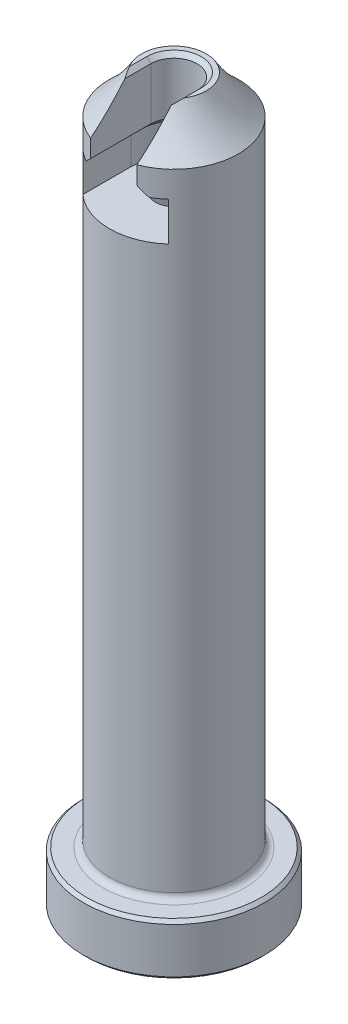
SolidWorks part; units mm, degrees
ref_plane "Front Plane" through (0, 0, 0) normal (0, 0, 1) x (1, 0, 0)
ref_plane "Top Plane" through (0, 0, 0) normal (0, 1, 0) x (1, 0, 0)
ref_plane "Right Plane" through (0, 0, 0) normal (1, 0, 0) x (0, 0, -1)
sketch "Sketch1" plane through (0, 0, 0) normal (0, 0, 1) x (1, 0, 0)
  line L0 (0, 0) -> (-11.1125, 0)
  line L1 (-11.1125, 0) -> (-11.1125, 6.35)
  line L2 (-11.1125, 6.35) -> (-7.9375, 6.35)
  line L3 (-7.9375, 6.35) -> (-7.9375, 84.1756)
  line L4 (-3.9624, 88.9) -> (0, 88.9)
  line L5 (0, 88.9) -> (0, 0)
  line L6 (0, 260.1044) -> (0, -42.4425) construction
  arc A0 (-3.9624, 88.9) -> (-7.9375, 84.1756) centre (-20.3339, 98.6404) cw
  dimension "D3" = 19.05
  dimension "D1" = 88.9
  dimension "D2" = 7.9248
  dimension "D" = 15.875
  dimension "H" = 22.225
  dimension "D4" = 6.35
  dimension "D5" = 4.7244
revolve "Revolve1" add sketch "Sketch1" angle 360 about L6
sketch "Sketch2" plane through (0, 0, 0) normal (0, -1, 0) x (1, 0, 0)
  circle A0 centre (0, 0) radius 2.286
  dimension "K" = 4.572
extrude "Cut-Extrude1" cut sketch "Sketch2" against normal through all
sketch "Sketch3" plane through (0, 0, 0) normal (0, 0, 1) x (1, 0, 0)
  line L0 (0, 88.9) -> (0, 76.2)
  line L1 (2.286, 88.9) -> (-2.286, 88.9) construction
  line L2 (0, 76.2) -> (-5.2832, 76.2)
  line L3 (-5.2832, 76.2) -> (-5.2832, 80.9752)
  line L4 (-5.2832, 80.9752) -> (-2.8448, 80.9752)
  line L5 (-2.8448, 80.9752) -> (-2.8448, 88.9)
  line L6 (7.9375, 88.9) -> (-7.9375, 88.9) construction
  line L7 (-2.8448, 88.9) -> (0, 88.9)
  line L8 (0, 234.4529) -> (0, 203.2033) construction
  dimension "B" = 10.5664
  dimension "A" = 5.6896
  dimension "T" = 4.7752
  dimension "D4" = 12.7
revolve "Cut-Revolve1" cut sketch "Sketch3" angle 360 about L8
sketch "Sketch4" plane through (0, 76.2, 0) normal (0, 1, 0) x (1, 0, 0)
  line L0 (-5.2832, 0) -> (-5.2832, -5.9238)
  line L1 (5.2832, 0) -> (5.2832, -5.9238)
  circle A0 centre (0, 0) radius 7.9375 construction
  circle A1 centre (0, 0) radius 5.2832 construction
  arc A2 (5.2832, 0) -> (-5.2832, 0) centre (0, 0) ccw
  circle A3 centre (0, 0) radius 7.9375 construction
  arc A4 (-5.2832, -5.9238) -> (5.2832, -5.9238) centre (0, 0) ccw
extrude "Cut-Extrude2" cut sketch "Sketch4" along normal up to surface (4.7752 mm away)
sketch "Sketch5" plane through (0, 88.9, 0) normal (0, 1, 0) x (1, 0, 0)
  line L0 (-2.8448, 0) -> (-2.8448, -7.4102)
  line L1 (2.8448, 0) -> (2.8448, -7.4102)
  circle A0 centre (0, 0) radius 2.8448 construction
  arc A1 (2.8448, 0) -> (-2.8448, 0) centre (0, 0) ccw
  circle A2 centre (0, 0) radius 7.9375 construction
  arc A3 (-2.8448, -7.4102) -> (2.8448, -7.4102) centre (0, 0) ccw
extrude "Cut-Extrude3" cut sketch "Sketch5" against normal up to next
chamfer "Chamfer1" distance 1.016 angle 45 3 edges at (2.8448, 80.9752, 3.7051) (-2.8448, 80.9752, 3.7051) (0, 80.9752, -2.8448)
chamfer "Chamfer3" distance 0.381 angle 45 2 edges at (0, 6.35, 11.1125) (0, 0, 11.1125)
chamfer "Chamfer4" distance 0.762 angle 45 1 edges at (0, 0, -2.286)
chamfer "Chamfer8" distance 0.508 angle 45 3 edges at (2.8448, 88.9, 1.3791) (0, 88.9, -2.8448) (-2.8448, 88.9, 1.3791)
fillet "Fillet1" radius 0.762 1 edges at (0, 6.35, 7.9375)
